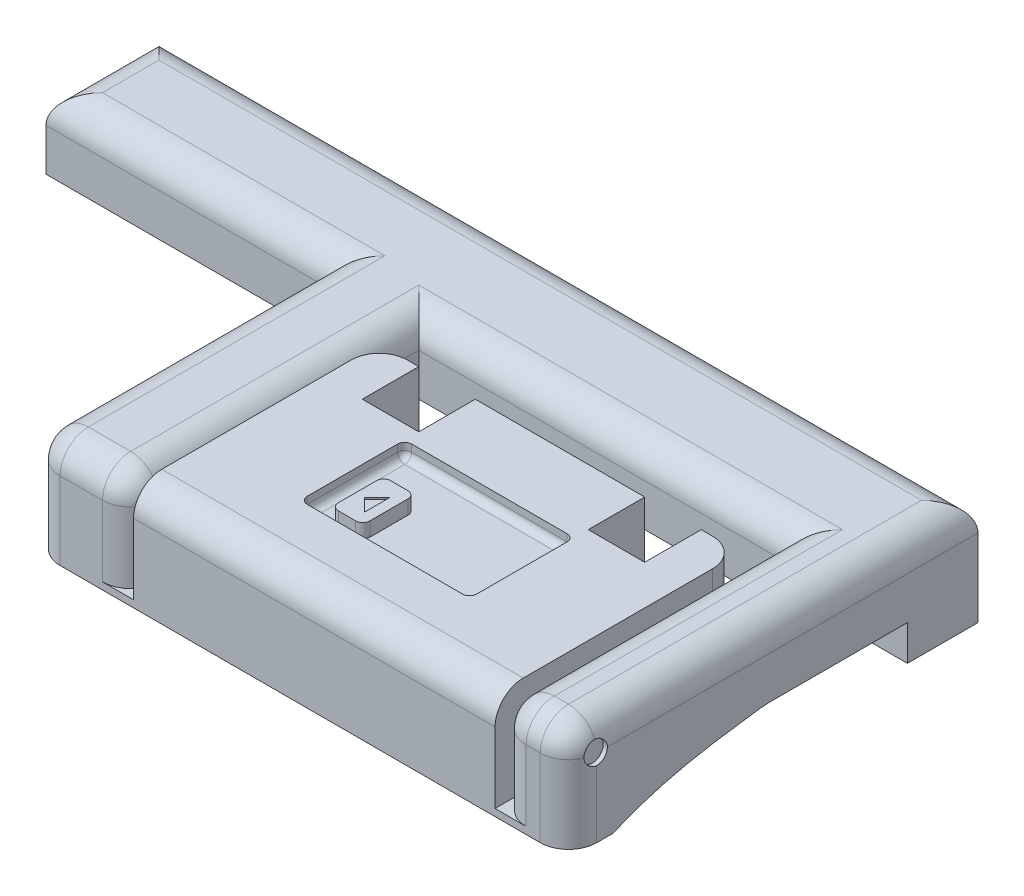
SolidWorks part; units mm, degrees
ref_plane "Plan de face" through (0, 0, 0) normal (0, 0, 1) x (1, 0, 0)
ref_plane "Plan de dessus" through (0, 0, 0) normal (0, 1, 0) x (1, 0, 0)
ref_plane "Plan de droite" through (0, 0, 0) normal (1, 0, 0) x (0, 0, -1)
sketch "Esquisse1" plane through (0, 0, 0) normal (0, 1, 0) x (1, 0, 0)
  line L0 (0, 0) -> (58, 0)
  line L1 (58, 0) -> (58, -29)
  line L2 (58, -29) -> (20, -29)
  line L3 (20, -29) -> (20, -8)
  line L4 (20, -8) -> (0, -8)
  line L5 (0, -8) -> (0, 0)
  dimension "D1" = 8
  dimension "D2" = 29
  dimension "D3" = 58
  dimension "D4" = 38
extrude "Extrusion1" add sketch "Esquisse1" along normal blind 7.5
sketch "Esquisse2" plane through (58, 0, 0) normal (1, 0, 0) x (0, 0, -1)
  line L0 (-32.1, 0) -> (-25.8576, 0) construction
  line L1 (-32.1, 0) -> (-25.8576, 0)
  line L2 (-5, -2.5) -> (-5, 0.5) construction
  line L3 (-5, -2.5) -> (-5, 0.5)
  line L4 (-15.4273, 2.4567) -> (-14.7707, 2.5)
  line L5 (-14.7707, 2.5) -> (-7, 2.5)
  line L6 (-5, 0.5) -> (-5, 2.5)
  line L7 (-5, 2.5) -> (-7, 2.5)
  line L8 (-32.1, 0) -> (-25.8576, -3.1418)
  line L9 (-25.8576, -3.1418) -> (-5, -2.5)
  point P5 (-28.265, -1.0856)
  point P13 (-26.6506, -0.3399)
  point P14 (-24.6, -3.9866)
extrude "Enlèv. mat.-Extru.1" cut sketch "Esquisse2" against normal blind 63
sketch "Esquisse3" plane through (0, 7.5, 0) normal (0, 1, 0) x (-1, 0, 0)
  line L0 (-60.5, 8.6) -> (-1.5, 8.6) construction
  line L1 (-27, 8.6) -> (-53, 8.6)
  line L2 (-27, 8.6) -> (-27, 11.6)
  line L3 (-27, 11.6) -> (-30, 11.6)
  line L4 (-53, 8.6) -> (-53, 11.6)
  line L5 (-58, 29) -> (-58, 0) construction
  line L6 (-20, 8) -> (-20, 29) construction
  line L7 (-50, 14.7707) -> (-50, 9.1) construction
  line L8 (-30, 9.1) -> (-30, 14.7707) construction
  line L10 (-30, 27.399) -> (-30, 15.1647) construction
  line L12 (-34, 11.6) -> (-34, 15.6)
  line L13 (-34, 15.6) -> (-30, 15.6)
  line L14 (-30, 11.6) -> (-30, 15.6)
  line L15 (-50, 11.6) -> (-53, 11.6)
  line L16 (-34, 11.6) -> (-46, 11.6)
  line L17 (-46, 11.6) -> (-46, 15.6)
  line L18 (-46, 15.6) -> (-50, 15.6)
  line L19 (-50, 11.6) -> (-50, 15.6)
  point P10 (-50, 11.9354)
  point P13 (-30, 11.9354)
  dimension "D1" = 5
  dimension "D2" = 7
  dimension "D3" = 3
  dimension "D4" = 4
  dimension "D5" = 4
  dimension "D6" = 12
  dimension "D7" = 4
extrude "Enlèv. mat.-Extru.2" cut sketch "Esquisse3" against normal through all
sketch "Esquisse5" plane through (0, 7.5, 0) normal (0, 1, 0) x (-1, 0, 0)
  line L0 (-20, 29) -> (-58, 29) construction
  line L1 (-53, 11.6) -> (-52.8, 11.6)
  line L2 (-53, 11.6) -> (-53, 29)
  line L3 (-53, 29) -> (-52.8, 29)
  line L4 (-52.8, 11.6) -> (-52.8, 29)
  line L6 (-27, 11.6) -> (-27.2, 11.6)
  line L7 (-27, 11.6) -> (-27, 29)
  line L8 (-27, 29) -> (-27.2, 29)
  line L9 (-27.2, 11.6) -> (-27.2, 29)
  dimension "D1" = 0.2
  dimension "D2" = 0.2
extrude "Enlèv. mat.-Extru.3" cut sketch "Esquisse5" against normal blind 7
sketch "Esquisse6" plane through (0, 7.5, 0) normal (0, 1, 0) x (-1, 0, 0)
  line L0 (-46, 11.6) -> (-46, 15.6) construction
  line L1 (-46, 16.6) -> (-34, 16.6)
  line L2 (-46, 16.6) -> (-46, 24)
  line L3 (-46, 24) -> (-34, 24)
  line L4 (-34, 16.6) -> (-34, 24)
  line L5 (-34, 15.6) -> (-34, 11.6) construction
  line L6 (-27.2, 29) -> (-52.8, 29) construction
  line L7 (-34, 11.6) -> (-46, 11.6) construction
  dimension "D1" = 5
  dimension "D2" = 5
extrude "Enlèv. mat.-Extru.4" cut sketch "Esquisse6" against normal blind 1
sketch "Esquisse7" plane through (0, 6.5, 0) normal (0, 1, 0) x (-1, 0, 0)
  line L0 (-35.5, 28.265) -> (-35.5, 15.4273) construction
  line L1 (-37.7285, 19.5952) -> (-35.5, 19.5952)
  line L2 (-37.7285, 19.5952) -> (-37.7285, 23.2936)
  line L3 (-37.7285, 23.2936) -> (-35.5, 23.2936)
  line L4 (-35.5, 19.5952) -> (-35.5, 23.2936)
extrude "Extrusion2" add sketch "Esquisse7" along normal blind 1
sketch "Esquisse8" plane through (0, 7.5, 0) normal (0, 1, 0) x (-1, 0, 0)
  line L0 (-37.004, 20.6729) -> (-37.004, 22.4535)
  line L1 (-37.004, 22.4535) -> (-36.1137, 21.5632)
  line L2 (-36.1137, 21.5632) -> (-37.004, 20.6729)
extrude "Enlèv. mat.-Extru.5" cut sketch "Esquisse8" against normal blind 0.1
fillet "Congé2" radius 0.5 4 edges at (37.7285, 7, 23.2936) (35.5, 7, 23.2936) (35.5, 7, 19.5952) (37.7285, 7, 19.5952)
fillet "Congé3" radius 0.5 8 edges at (46, 7, 16.6) (46, 6.5, 20.3) (46, 7, 24) (40, 6.5, 24) (40, 6.5, 16.6) (34, 6.5, 20.3) (34, 7, 16.6) (34, 7, 24)
fillet "Congé4" radius 2 3 edges at (55.5, 7.5, 29) (40, 7.5, 29) (23.5, 7.5, 29)
fillet "Congé5" radius 2 16 edges at (27, 3, 29) (27, 6.9142, 28.4142) (20, 2.75, 29) (20, 6.9142, 28.4142) (58, 2.75, 29) (58, 6.9142, 28.4142) (53, 3, 29) (53, 6.9142, 28.4142) (40, 7.5, 8.6) (27, 7.5, 17.8) (20, 7.5, 17.5) (10, 7.5, 8) (0, 7.5, 4) (29, 7.5, 0) (58, 7.5, 13.5) (53, 7.5, 17.8)
fillet "Congé6" radius 2 2 edges at (52.8, 5, 11.6) (27.2, 5, 11.6)
sketch "Esquisse10" plane through (58, 0, 0) normal (1, 0, 0) x (0, 0, -1)
  circle A0 centre (-27, 5.5) radius 0.7587
extrude "Enlèv. mat.-Extru.7" cut sketch "Esquisse10" against normal blind 0.3
sketch "Esquisse11" plane through (20, 0, 0) normal (-1, 0, 0) x (0, 0, 1)
  circle A0 centre (27, 5.5) radius 0.7587 construction
  circle A1 centre (27, 5.5) radius 0.7587
extrude "Enlèv. mat.-Extru.8" cut sketch "Esquisse11" against normal blind 0.3
